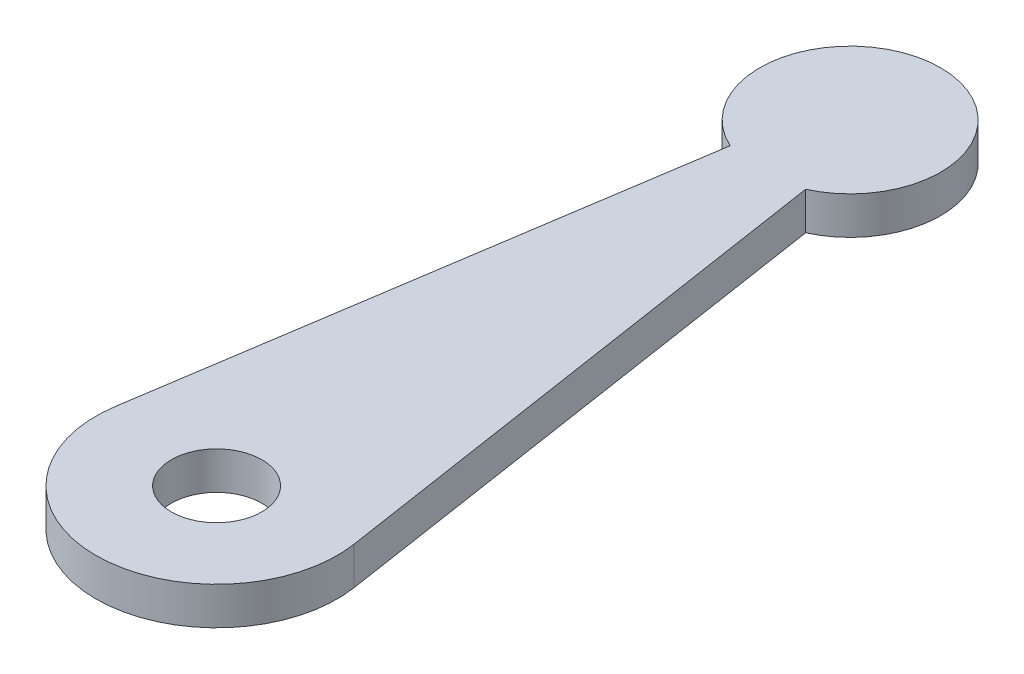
SolidWorks part; units mm, degrees
ref_plane "Front" through (0, 0, 0) normal (0, 0, 1) x (1, 0, 0)
ref_plane "Top" through (0, 0, 0) normal (0, 1, 0) x (1, 0, 0)
ref_plane "Right" through (0, 0, 0) normal (1, 0, 0) x (0, 0, -1)
sketch "Sketch1" plane through (0, 0, 0) normal (0, 1, 0) x (1, 0, 0)
  line L3 (-2.5008, 36.5458) -> (-7.9079, 1.2101)
  line L4 (2.5005, 36.5458) -> (7.9079, 1.2101)
  arc A0 (2.5005, 36.5458) -> (-2.5008, 36.5458) centre (-0.0001, 41.9998) ccw
  circle A1 centre (0, 0) radius 3
  arc A2 (-7.9079, 1.2101) -> (7.9079, 1.2101) centre (0, 0) ccw
  dimension "D1" = 6
  dimension "D2" = 6
extrude "Extrude1" add sketch "Sketch1" along normal blind 2.5
